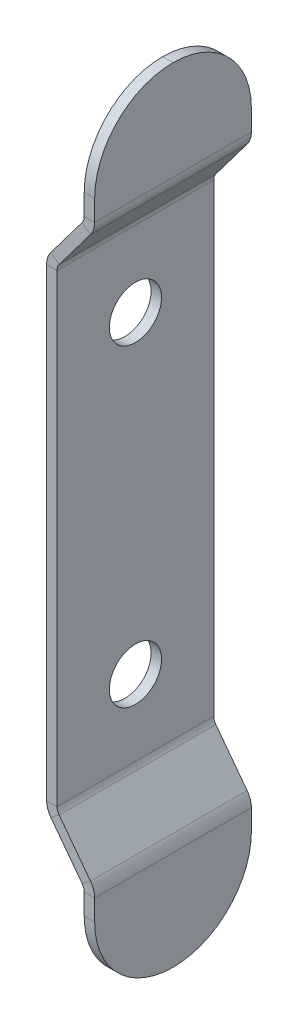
SolidWorks part; units mm, degrees
ref_plane "Plan1" through (0, 0, 0) normal (0, 0, 1) x (1, 0, 0)
ref_plane "Plan2" through (0, 0, 0) normal (0, 1, 0) x (1, 0, 0)
ref_plane "Plan3" through (0, 0, 0) normal (1, 0, 0) x (0, 0, -1)
sketch "Esquisse2" plane through (0, 0, 0) normal (0, 0, 1) x (1, 0, 0)
  line L0 (0, 4.5445) -> (0, -4.5445)
  line L1 (0.72, 5.5) -> (0, 4.5445)
  line L2 (0.72, 5.5) -> (0.72, 7.5)
  line L3 (-6.311, 0) -> (6.311, 0) construction
  line L4 (0.72, -5.5) -> (0.72, -7.5)
  line L5 (0.72, -5.5) -> (0, -4.5445)
  point P10 (0, 0)
  dimension "D1" = 143
  dimension "D2" = 7.5
  dimension "D3" = 0.72
  dimension "D4" = 2
extrude "contact" add sketch "Esquisse2" along normal mid plane 3 thin
sheet metal parameters "Tôlerie 1" parameters "D1"=0.2
bend "Pli dans angle2" parameters "D1"=0
flatten bends "Dépliage 1" parameters "D1"=0, "D4"=37, "D5"=1
sketch "Esquisse-Angle1" plane through (-0.1, 0, 0) normal (-1, 0, 0) x (0, 0, 1)
  line L0 (1.5, -4.541) -> (-1.5, -4.541) construction
  line L1 (-1.5, -5.7304) -> (1.5, -5.7304) construction
  line L2 (-1.5, 4.541) -> (1.5, 4.541) construction
  line L3 (1.5, 5.7304) -> (-1.5, 5.7304) construction
bend "Pli dans angle1" bend angle 37 parameters "D1"=0, "D5"=3
bend "Pli dans angle3" bend angle 37 parameters "D1"=0, "D5"=2
bend "Pli dans angle4" bend angle 37 parameters "D1"=0, "D5"=4
process bends "Pliage 1" parameters "D1"=0
sketch "Esquisse-Plate1" plane through (-0.1, 0, 0) normal (-1, 0, 0) x (0, 0, 1)
fillet "rayon1.5" radius 1.5
sketch "Esquisse5" plane through (0.1, 0, 0) normal (1, 0, 0) x (0, 0, -1)
  line L0 (-2.2649, 0) -> (2.6075, 0) construction
  circle A0 centre (0, -3) radius 0.5
  circle A1 centre (0, 3) radius 0.5
  dimension "D1" = 1
  dimension "D2" = 3
extrude "perçage" cut sketch "Esquisse5" against normal through all
